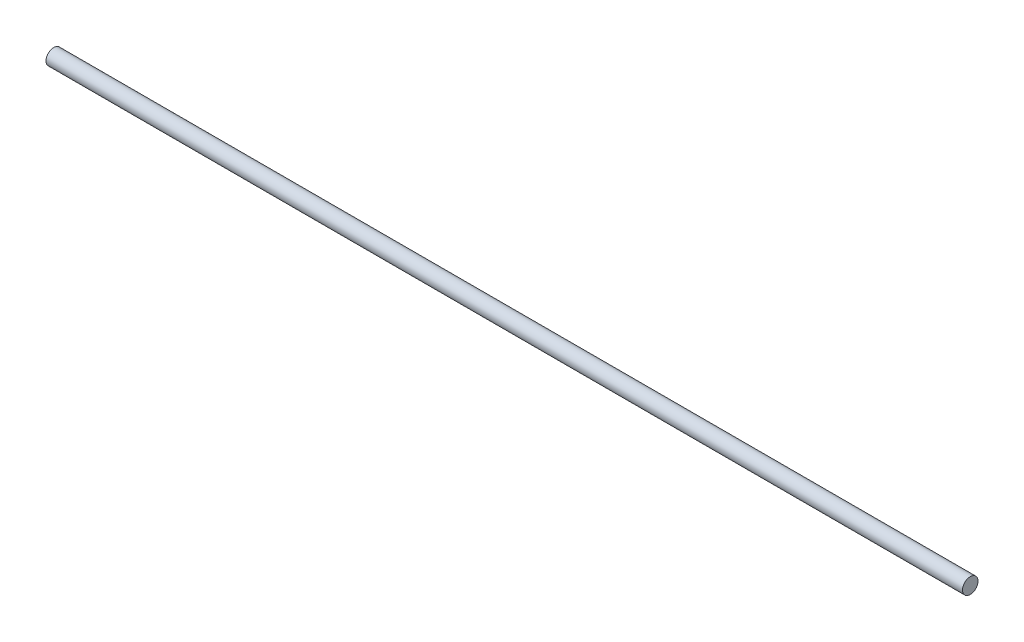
SolidWorks part; units mm, degrees
ref_plane "Ebene vorne" through (0, 0, 0) normal (0, 0, 1) x (1, 0, 0)
ref_plane "Ebene oben" through (0, 0, 0) normal (0, 1, 0) x (1, 0, 0)
ref_plane "Ebene rechts" through (0, 0, 0) normal (1, 0, 0) x (0, 0, -1)
sketch "Skizze1" plane through (0, 0, 0) normal (0, 0, 1) x (1, 0, 0)
  line L0 (-430.5296, 0) -> (425.6037, 0) construction
  line L1 (331.7601, 0) -> (-317.9514, 0)
  line L3 (-317.9514, 0) -> (-317.9514, -5.5)
  line L4 (-317.9514, -5.5) -> (331.7601, -5.5)
  line L5 (331.7601, 0) -> (331.7601, -5.5)
  dimension "D1" = 5.5
revolve "Rotation1" add sketch "Skizze1" angle 360 about L0
